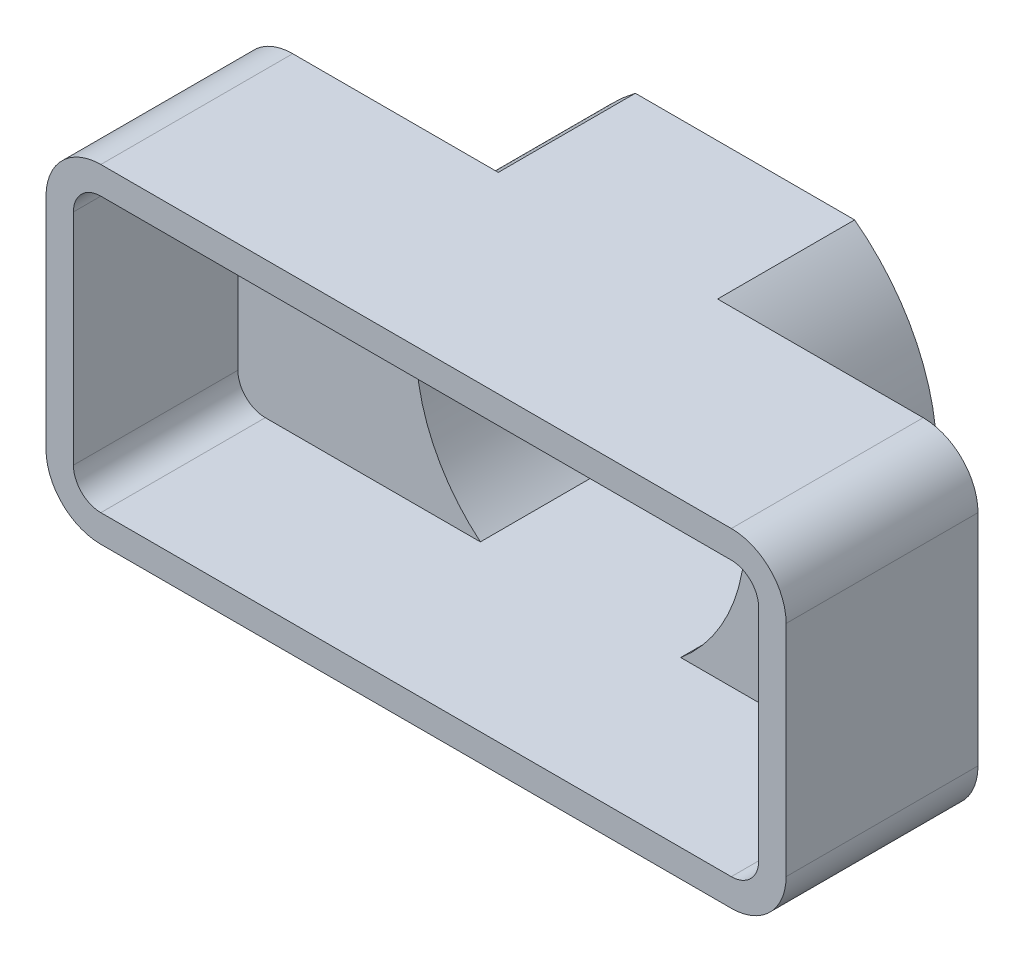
SolidWorks part; units mm, degrees
ref_plane "Plan de face" through (0, 0, 0) normal (0, 0, 1) x (1, 0, 0)
ref_plane "Plan de dessus" through (0, 0, 0) normal (0, 1, 0) x (1, 0, 0)
ref_plane "Plan de droite" through (0, 0, 0) normal (1, 0, 0) x (0, 0, -1)
sketch "Esquisse1" plane through (0, 0, 0) normal (0, 0, 1) x (1, 0, 0)
  line L0 (9.8347, 0) -> (-8.3467, 0) construction
  line L1 (4, 6) -> (-4, 6)
  line L2 (4, 6) -> (4, -6) construction
  line L3 (4, -6) -> (-4, -6)
  line L4 (-4, 6) -> (-4, -6) construction
  line L5 (7, 0) -> (-7, 0) construction
  line L6 (3.6533, 5) -> (-3.6533, 5)
  line L7 (3.6533, -5) -> (-3.6533, -5)
  arc A0 (-4, 6) -> (-4, -6) centre (0.5, 0) ccw
  arc A1 (4, 6) -> (4, -6) centre (-0.5, 0) cw
  arc A2 (-3.6533, 5) -> (-3.6533, -5) centre (0.5, 0) ccw
  arc A3 (3.6533, 5) -> (3.6533, -5) centre (-0.5, 0) cw
  dimension "D3" = 4
  dimension "D5" = 7.5
  dimension "D6" = 7.5
  dimension "D4" = 12
  dimension "D1" = 8
  dimension "D2" = 6
  dimension "D7" = 14
  dimension "D8" = 1
extrude "Boss.-Extru.1" add sketch "Esquisse1" along normal blind 5
sketch "Esquisse2" plane through (0, 0, 5) normal (0, 0, 1) x (1, 0, 0)
  line L0 (-3.6533, 5) -> (3.6533, 5)
  line L1 (-11.5, -6) -> (11.5, -6)
  line L2 (-13.5, -4) -> (-13.5, 4)
  line L3 (-11.5, 6) -> (11.5, 6)
  line L4 (13.5, -4) -> (13.5, 4)
  line L5 (-13.5, -6) -> (13.5, 6) construction
  line L6 (-13.5, 6) -> (13.5, -6) construction
  line L7 (-3.6533, -5) -> (3.6533, -5)
  arc A0 (-13.5, 4) -> (-11.5, 6) centre (-11.5, 4) cw
  arc A1 (11.5, -6) -> (13.5, -4) centre (11.5, -4) ccw
  arc A2 (11.5, 6) -> (13.5, 4) centre (11.5, 4) cw
  arc A3 (-11.5, -6) -> (-13.5, -4) centre (-11.5, -4) cw
  circle A4 centre (-11.5, 0) radius 0.5
  arc A5 (3.6533, 5) -> (3.6533, -5) centre (-0.5, 0) cw
  arc A6 (-3.6533, 5) -> (-3.6533, -5) centre (0.5, 0) ccw
  point P0 (0, 0)
  dimension "D3" = 2
  dimension "D4" = 2
  dimension "D5" = 11.5
  dimension "D1" = 12
  dimension "D2" = 27
extrude "Boss.-Extru.2" add sketch "Esquisse2" along normal blind 7
sketch "Esquisse3" plane through (0, 0, 12) normal (0, 0, 1) x (1, 0, 0)
  line L1 (-11.5, -5) -> (11.5, -5)
  line L2 (-12.5, -4) -> (-12.5, 4)
  line L3 (-11.5, 5) -> (11.5, 5)
  line L4 (12.5, -4) -> (12.5, 4)
  line L5 (-12.5, -5) -> (12.5, 5) construction
  line L6 (-12.5, 5) -> (12.5, -5) construction
  arc A0 (11.5, 5) -> (12.5, 4) centre (11.5, 4) cw
  arc A1 (11.5, -5) -> (12.5, -4) centre (11.5, -4) ccw
  arc A2 (-11.5, -5) -> (-12.5, -4) centre (-11.5, -4) cw
  arc A3 (-12.5, 4) -> (-11.5, 5) centre (-11.5, 4) cw
  point P0 (0, 0)
  dimension "D3" = 1
  dimension "D1" = 10
  dimension "D2" = 25
extrude "Enlèv. mat.-Extru.1" cut sketch "Esquisse3" against normal blind 6
sketch "Esquisse6" plane through (0, 0, 0) normal (0, 0, -1) x (-1, 0, 0)
  line L0 (-4, 6) -> (4, 6)
  line L1 (-4, -6) -> (4, -6)
  arc A0 (-4, 6) -> (-4, -6) centre (0.5, 0) ccw
  arc A1 (4, 6) -> (4, -6) centre (-0.5, 0) cw
  circle A2 centre (0, 0) radius 1
extrude "Boss.-Extru.3" add sketch "Esquisse6" against normal blind 1
